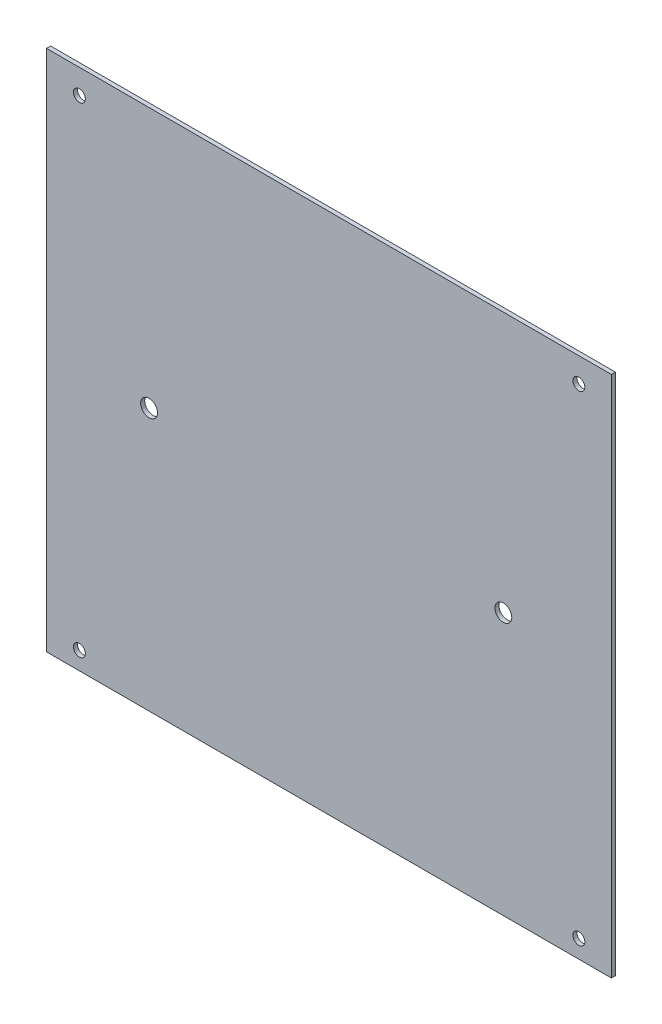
SolidWorks part; units mm, degrees
ref_plane "Front Plane" through (0, 0, 0) normal (0, 0, 1) x (1, 0, 0)
ref_plane "Top Plane" through (0, 0, 0) normal (0, 1, 0) x (1, 0, 0)
ref_plane "Right Plane" through (0, 0, 0) normal (1, 0, 0) x (0, 0, -1)
sketch "Sketch2" plane through (0, 0, 0) normal (0, 0, 1) x (1, 0, 0)
  line L1 (0, 0) -> (97.25, 0)
  line L2 (0, 0) -> (0, 90)
  line L3 (0, 90) -> (97.25, 90)
  line L4 (97.25, 0) -> (97.25, 90)
extrude "Boss-Extrude1" add sketch "Sketch2" along normal blind 2
sketch "Sketch12" plane through (0, 0, 2) normal (0, 0, 1) x (1, 0, 0)
  point P0 (78.65, 45.18)
  point P1 (17.65, 45.18)
hole_wizard "CSK for M2.5 Flat Head Machine Screw3" positions "Sketch14" profile "Sketch13" countersink size "M2.5" standard "ANSI Metric"
sketch "Sketch14" plane through (0, 0, 2) normal (0, 0, 1) x (1, 0, 0)
  point P0 (78.65, 45.18)
  point P3 (17.65, 45.18)
sketch "Sketch13" plane through (78.65, 45.18, 2) normal (1, 0, 0) x (0, -1, 0)
  line L0 (0, 0) -> (0, 2)
  line L1 (0, 2) -> (1.45, 2)
  line L2 (1.45, 2) -> (1.45, 1.3)
  line L3 (1.45, 1.3) -> (2.75, 0)
  line L5 (2.75, 0) -> (0, 0)
  line L6 (-1.45, 1.3) -> (-2.75, 0) construction
  line L11 (0, -6.35) -> (0, 107.95) construction
  dimension "Thru Hole Dia." = 2.9
  dimension "Thru Hole Depth" = 2
  dimension "Near C'Sink Dia." = 5.5
  dimension "Near C'Sink Angle" = 90
sketch "Sketch19" plane through (0, 0, 0) normal (0, 0, -1) x (-1, 0, 0)
  point P0 (-91.65, 3.08)
  point P1 (-5.65, 3.08)
  point P3 (-5.65, 85.78)
  point P5 (-91.65, 85.78)
hole_wizard "M2.5x0.45 Tapped Hole1" positions "Sketch26" profile "Sketch25" tap size "M2.5x0.45" standard "ANSI Metric"
sketch "Sketch26" plane through (0, 0, 0) normal (0, 0, -1) x (-1, 0, 0)
  point P0 (-91.65, 3.08)
  point P3 (-5.65, 3.08)
  point P6 (-5.65, 85.78)
  point P9 (-91.65, 85.78)
sketch "Sketch25" plane through (91.65, 3.08, 0) normal (1, 0, 0) x (0, 1, 0)
  line L0 (0, 0) -> (0, 6.9659)
  line L1 (0, 6.9659) -> (1.025, 6.35)
  line L2 (1.025, 6.35) -> (1.025, 0)
  line L5 (1.025, 0) -> (0, 0)
  line L10 (0, 6.9659) -> (-1.025, 6.35) construction
  line L11 (0, -6.35) -> (0, 107.95) construction
  dimension "Tap Drill Dia." = 2.05
  dimension "Tap Drill Depth" = 6.35
  dimension "Drill Angle" = 118
hole_wizard "CSK for M2.5 Flat Head Machine Screw5" positions "Sketch28" profile "Sketch27" countersink size "M2.5" standard "ANSI Metric"
sketch "Sketch28" [suppressed] plane through (0, 0, 2) normal (0, 0, 1) x (1, 0, 0)
  point P0 (91.65, 85.78)
  point P3 (91.65, 3.08)
  point P6 (5.65, 3.08)
  point P9 (5.65, 85.78)
sketch "Sketch27" plane through (91.65, 85.78, 2) normal (1, 0, 0) x (0, -1, 0)
  line L0 (0, 0) -> (0, 2)
  line L1 (0, 2) -> (1.45, 2)
  line L2 (1.45, 2) -> (1.45, 1.3)
  line L3 (1.45, 1.3) -> (2.75, 0)
  line L5 (2.75, 0) -> (0, 0)
  line L6 (-1.45, 1.3) -> (-2.75, 0) construction
  line L11 (0, -6.35) -> (0, 107.95) construction
  dimension "Thru Hole Dia." = 2.9
  dimension "Thru Hole Depth" = 2
  dimension "Near C'Sink Dia." = 5.5
  dimension "Near C'Sink Angle" = 90
sketch "Sketch29" plane through (0, 0, 2) normal (0, 0, 1) x (1, 0, 0)
  line L1 (0, 90) -> (97.25, 90)
  line L2 (0, 90) -> (0, 0)
  line L3 (0, 0) -> (97.25, 0)
  line L4 (97.25, 90) -> (97.25, 0)
extrude "Cut-Extrude1" cut sketch "Sketch29" against normal offset from surface (1.3 mm away) 0.7
